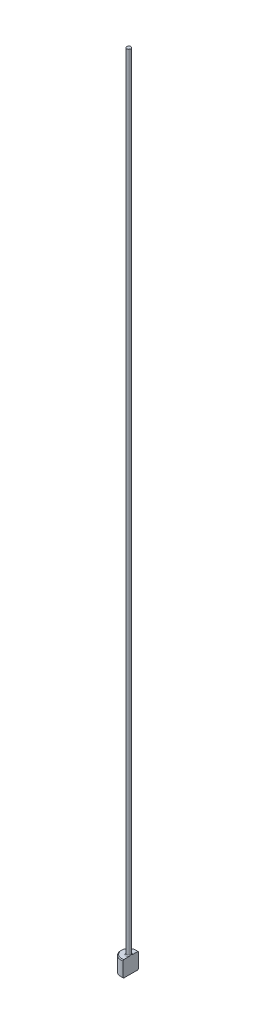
SolidWorks part; units mm, degrees
ref_plane "Front Plane" through (0, 0, 0) normal (0, 0, 1) x (1, 0, 0)
ref_plane "Top Plane" through (0, 0, 0) normal (0, 1, 0) x (1, 0, 0)
ref_plane "Right Plane" through (0, 0, 0) normal (1, 0, 0) x (0, 0, -1)
sketch "Sketch1" plane through (0, 0, 0) normal (0, 0, 1) x (1, 0, 0)
  line L0 (0, 259.9588) -> (0, -15.1925) construction
  line L1 (0, 0) -> (-2, 0)
  line L2 (-2, 0) -> (-2, 4)
  line L3 (-2, 4) -> (-0.5, 4)
  line L4 (-0.5, 4) -> (-0.5, 200)
  line L5 (-0.5, 200) -> (0, 200)
  line L6 (0, 200) -> (0, 0)
  dimension "L" = 200
  dimension "H" = 4
  dimension "T" = 4
  dimension "D" = 1
revolve "Revolve1" add sketch "Sketch1" angle 360 about L0
chamfer "Chamfer1" distance 0.2 angle 45 2 edges at (0, 4, 2) (0, 0, 2)
fillet "Fillet1" radius 0.2 1 edges at (0, 4, 0.5)
sketch "Sketch2" plane through (0, 0, 0) normal (0, 1, 0) x (1, 0, 0)
  line L0 (0.5, -1.9365) -> (0.5, 1.9365)
  circle A0 centre (0, 0) radius 2 construction
  arc A1 (0.5, -1.9365) -> (0.5, 1.9365) centre (0, 0) ccw
  circle A2 centre (0, 0) radius 0.5 construction
extrude "KEYED HEAD" cut sketch "Sketch2" along normal through all
